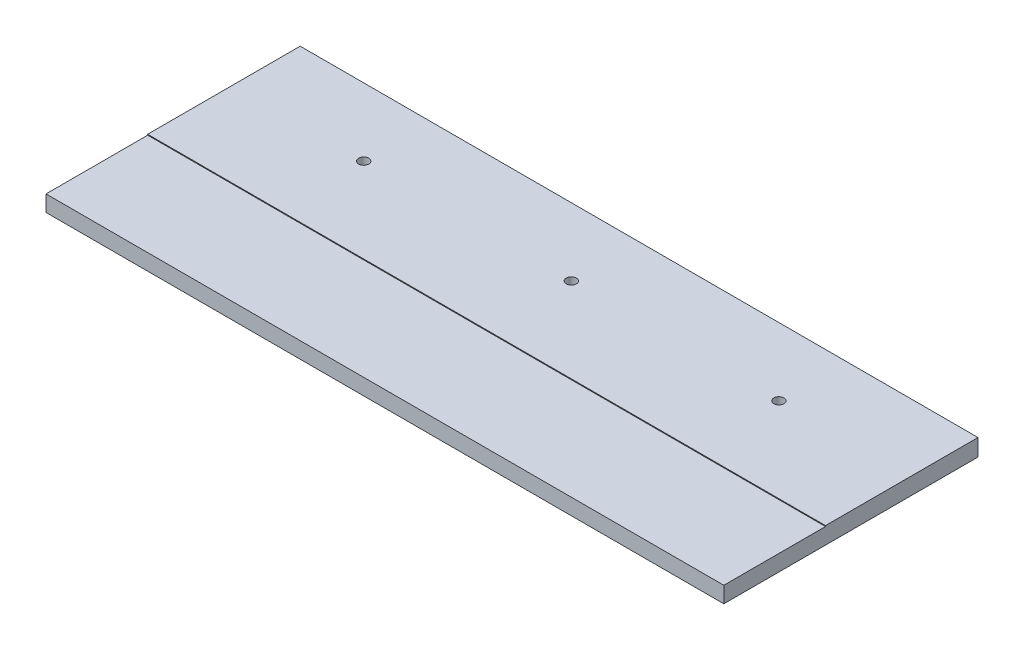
SolidWorks part; units mm, degrees
ref_plane "Plan de face" through (0, 0, 0) normal (0, 0, 1) x (1, 0, 0)
ref_plane "Plan de dessus" through (0, 0, 0) normal (0, 1, 0) x (1, 0, 0)
ref_plane "Plan de droite" through (0, 0, 0) normal (1, 0, 0) x (0, 0, -1)
sketch "Esquisse1" plane through (0, 0, 0) normal (0, 1, 0) x (1, 0, 0)
  line L1 (-400, 150) -> (400, 150)
  line L2 (-400, 150) -> (-400, -150)
  line L3 (-400, -150) -> (400, -150)
  line L4 (400, 150) -> (400, -150)
  line L6 (400, 70) -> (-400, 70) construction
  line L8 (0, 0) -> (0, 150) construction
  circle A0 centre (0, 70) radius 6
  circle A1 centre (245, 70) radius 6
  circle A2 centre (-245, 70) radius 6
  dimension "D4" = 245
  dimension "D1" = 800
  dimension "D2" = 300
  dimension "D3" = 80
extrude "Extrusion1" add sketch "Esquisse1" along normal blind 20
sketch "Esquisse2" plane through (0, 20, 0) normal (0, 1, 0) x (-1, 0, 0)
  line L1 (400, -150) -> (400, 150) construction
  line L2 (-400, 150) -> (400, 150)
  line L3 (-400, 150) -> (-400, 30)
  line L4 (-400, 30) -> (400, 30)
  line L5 (400, 150) -> (400, 30)
  dimension "D1" = 120
extrude "Enlèv. mat.-Extru.1" cut sketch "Esquisse2" against normal blind 1
